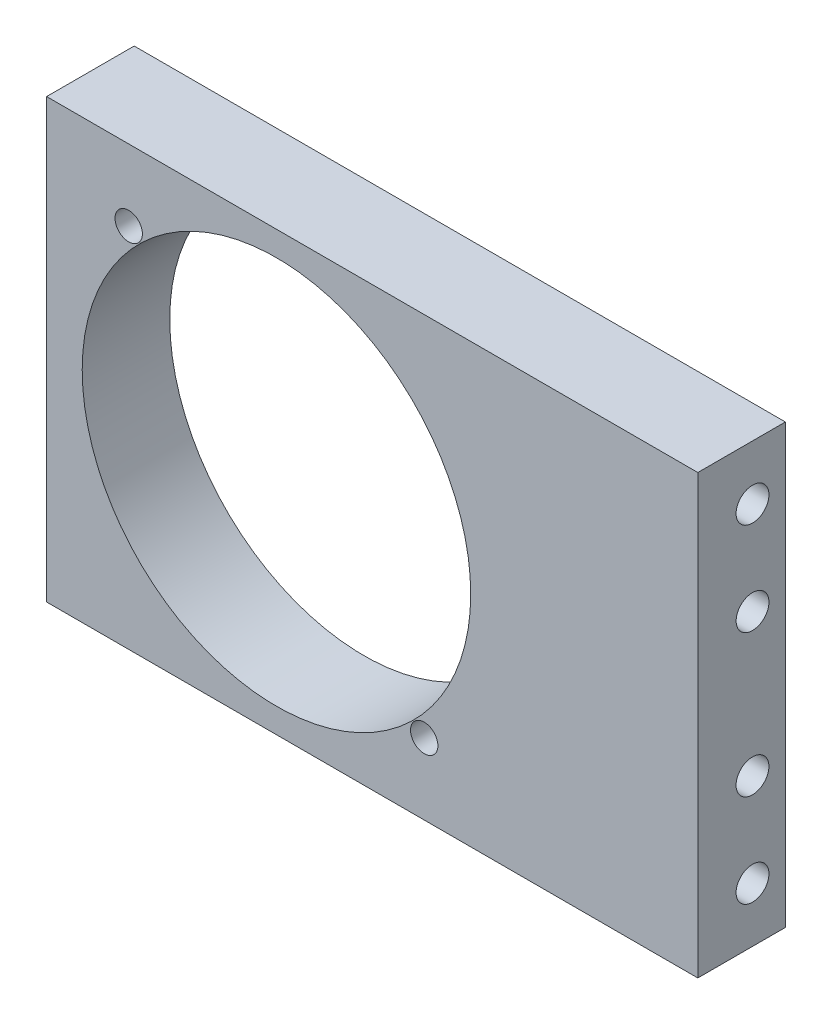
SolidWorks part; units mm, degrees
ref_plane "Face" through (0, 0, 0) normal (0, 0, 1) x (1, 0, 0)
ref_plane "Dessus" through (0, 0, 0) normal (0, 1, 0) x (1, 0, 0)
ref_plane "Droite" through (0, 0, 0) normal (1, 0, 0) x (0, 0, -1)
sketch "Esquisse1" plane through (0, 0, 0) normal (0, 0, 1) x (1, 0, 0)
  line L1 (0, 0) -> (59.5, 0)
  line L2 (0, 0) -> (0, 40)
  line L3 (0, 40) -> (59.5, 40)
  line L4 (59.5, 0) -> (59.5, 40)
  dimension "D1" = 59.5
  dimension "D2" = 40
extrude "Base-Extrusion" add sketch "Esquisse1" along normal blind 8
sketch "Esquisse2" plane through (0, 0, 0) normal (0, 0, 1) x (1, 0, 0)
  line L0 (0, 40) -> (0, 0) construction
  line L3 (0, 0) -> (59.5, 0) construction
  circle A0 centre (21, 20) radius 17.75
  dimension "D1" = 35.5
  dimension "D2" = 21
  dimension "D3" = 20
extrude "Enlèv. mat.-Extru.2" cut sketch "Esquisse2" along normal through all
hole_wizard "Trou taraudé M3x0.51" positions "Esquisse5" profile "Esquisse4" tap size "M3x0.5" standard "Ansi Métrique"
sketch "Esquisse5" plane through (0, 0, 0) normal (-1, 0, 0) x (0, 0, 1)
  line L0 (8, 40) -> (0, 40) construction
  line L1 (8, 40) -> (8, 0) construction
  point P0 (3, 35)
  dimension "D1" = 5
  dimension "D2" = 5
sketch "Esquisse4" plane through (0, 35, 3) normal (0, 1, 0) x (0, 0, 1)
  line L0 (0, 0) -> (0, 8.2217)
  line L1 (0, 8.2217) -> (1.25, 7.5)
  line L2 (1.25, 7.5) -> (1.25, 5)
  line L3 (1.25, 5) -> (1.5, 5)
  line L4 (1.5, 5) -> (1.5, 0)
  line L5 (1.5, 0) -> (0, 0)
  line L10 (0, 8.2217) -> (-1.25, 7.5) construction
  line L11 (0, -6.35) -> (0, 107.95) construction
  dimension "Diamètre du trou pour taraudage" = 2.5
  dimension "Profondeur du trou pour taraudage" = 7.5
  dimension "Diamètre du filetage" = 3
  dimension "Profondeur du filetage" = 5
  dimension "Angle de pointe" = 120
ref_plane "Plan1" through (0, 20, 0) normal (0, 1, 0) x (-1, 0, 0)
ref_plane "Plan2" through (29.75, 0, 0) normal (-1, 0, 0) x (0, 0, 1)
mirror "Symétrie2" about plane through (0, 20, 0) normal (0, 1, 0)
mirror "Symétrie3" about plane through (29.75, 0, 0) normal (-1, 0, 0)
hole_wizard "Trou taraudé M3x0.52" positions "Esquisse3D2" profile "Esquisse7" tap size "M3x0.5" standard "Ansi Métrique"
sketch3d "Esquisse3D2"
  line L0 (59.5, 0, 0) -> (59.5, 40, 0) construction
  circle A0 centre (59.5, 35, 3) radius 1.5 construction
  point P0 (59.5, 26.5, 3)
  point P5 (58, 35, 3)
  dimension "D1" = 3
  dimension "D2" = 8.5
sketch "Esquisse7" plane through (59.5, 26.5, 3) normal (0, 1, 0) x (0, 0, -1)
  line L0 (0, 0) -> (0, 8.2217)
  line L1 (0, 8.2217) -> (1.25, 7.5)
  line L2 (1.25, 7.5) -> (1.25, 5)
  line L3 (1.25, 5) -> (1.5, 5)
  line L4 (1.5, 5) -> (1.5, 0)
  line L5 (1.5, 0) -> (0, 0)
  line L10 (0, 8.2217) -> (-1.25, 7.5) construction
  line L11 (0, -6.35) -> (0, 107.95) construction
  dimension "Diamètre du trou pour taraudage" = 2.5
  dimension "Profondeur du trou pour taraudage" = 7.5
  dimension "Diamètre principal du filetage" = 3
  dimension "Profondeur du filetage" = 5
  dimension "Angle de pointe" = 120
hole_wizard "Trou taraudé M3x0.53" positions "Esquisse3D3" profile "Esquisse8" tap size "M3x0.5" standard "Ansi Métrique"
sketch3d "Esquisse3D3"
  line L0 (59.5, 0, 0) -> (59.5, 40, 0) construction
  circle A0 centre (59.5, 5, 3) radius 1.5 construction
  point P0 (59.5, 13.5, 3.0046)
  point P5 (58, 5, 3)
  dimension "D1" = 3.0046
  dimension "D2" = 8.5
sketch "Esquisse8" plane through (59.5, 13.5, 3.0046) normal (0, 1, 0) x (0, 0, -1)
  line L0 (0, 0) -> (0, 8.2217)
  line L1 (0, 8.2217) -> (1.25, 7.5)
  line L2 (1.25, 7.5) -> (1.25, 5)
  line L3 (1.25, 5) -> (1.5, 5)
  line L4 (1.5, 5) -> (1.5, 0)
  line L5 (1.5, 0) -> (0, 0)
  line L10 (0, 8.2217) -> (-1.25, 7.5) construction
  line L11 (0, -6.35) -> (0, 107.95) construction
  dimension "Diamètre du trou pour taraudage" = 2.5
  dimension "Profondeur du trou pour taraudage" = 7.5
  dimension "Diamètre principal du filetage" = 3
  dimension "Profondeur du filetage" = 5
  dimension "Angle de pointe" = 120
sketch "Esquisse9" plane through (0, 0, 8) normal (0, 0, 1) x (1, 0, 0)
  circle A0 centre (7.5, 33.5) radius 1.25
  circle A1 centre (21, 20) radius 17.75 construction
  circle A2 centre (34.5, 6.5) radius 1.25
  point P5 (0, 0)
  point P6 (-33.5, 7.5)
  dimension "D2" = 13.5
  dimension "D3" = 2.5
  dimension "D4" = 13.5
  dimension "D5" = 13.5
  dimension "D1" = 13.5
extrude "Enlèv. mat.-Extru.3" cut sketch "Esquisse9" against normal blind 10
